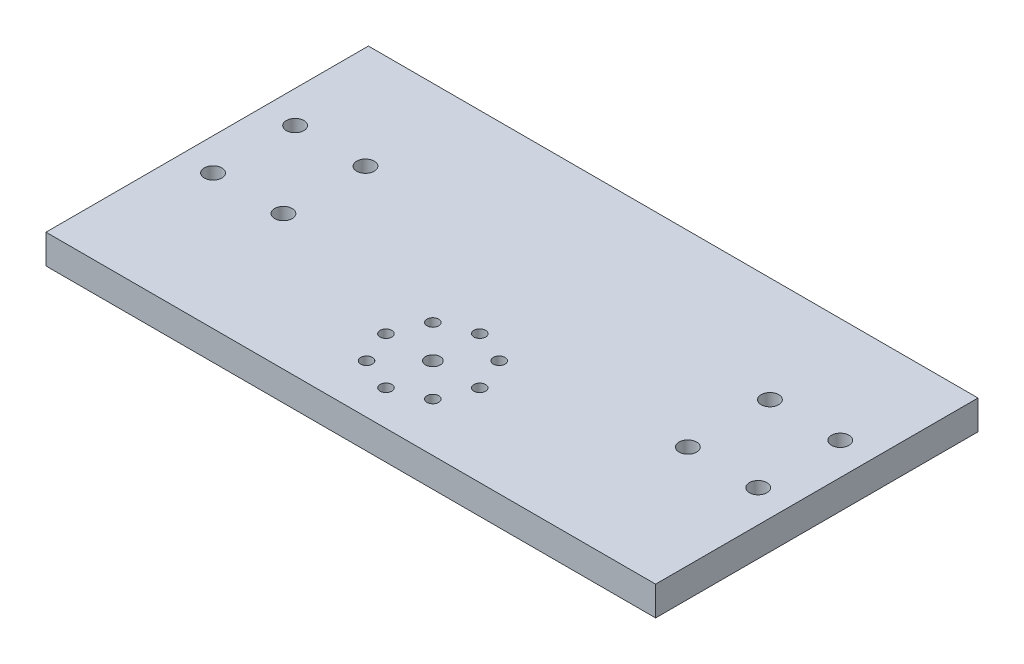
SolidWorks part; units mm, degrees
ref_plane "Front Plane" through (0, 0, 0) normal (0, 0, 1) x (1, 0, 0)
ref_plane "Top Plane" through (0, 0, 0) normal (0, 1, 0) x (1, 0, 0)
ref_plane "Right Plane" through (0, 0, 0) normal (1, 0, 0) x (0, 0, -1)
sketch "Sketch1" plane through (0, 0, 0) normal (0, 1, 0) x (1, 0, 0)
  line L0 (-52, 0) -> (52, 0) construction
  line L1 (-52, -25) -> (52, -25)
  line L2 (-52, -25) -> (-52, 25)
  line L3 (-52, 25) -> (52, 25)
  line L4 (52, -25) -> (52, 25)
  line L5 (-52, -25) -> (52, 25) construction
  line L6 (-52, 25) -> (52, -25) construction
  line L7 (0, 25) -> (0, -25) construction
  circle A0 centre (-46.5, 7) radius 1.5
  circle A1 centre (-34.5, 7) radius 1.5
  circle A2 centre (-34.5, -7) radius 1.5
  circle A3 centre (-46.5, -7) radius 1.5
  circle A4 centre (34.5, -7) radius 1.5
  circle A5 centre (46.5, -7) radius 1.5
  circle A6 centre (34.5, 7) radius 1.5
  circle A7 centre (46.5, 7) radius 1.5
  point P0 (0, 0)
  dimension "D3" = 7
  dimension "D4" = 7
  dimension "D5" = 3
  dimension "D6" = 3
  dimension "D1" = 104
  dimension "D2" = 50
  dimension "D7" = 12
  dimension "D8" = 5.5
extrude "Boss-Extrude1" add sketch "Sketch1" along normal blind 5
sketch "Sketch2" plane through (0, 0, 25) normal (0, 0, 1) x (1, 0, 0)
  line L1 (-52, 0) -> (52, 0)
  line L2 (-52, 0) -> (-52, 5)
  line L3 (-52, 5) -> (52, 5)
  line L4 (52, 0) -> (52, 5)
extrude "Boss-Extrude2" add sketch "Sketch2" along normal blind 5
sketch "Sketch4" plane through (0, 0, 0) normal (0, -1, 0) x (1, 0, 0)
  line L0 (0, 30) -> (0, -25) construction
  line L1 (-52, 30) -> (52, 30) construction
  line L2 (52, -25) -> (-52, -25) construction
  line L3 (-52, 16) -> (52, 16) construction
  line L4 (-52, -25) -> (-52, 30) construction
  line L5 (52, 30) -> (52, -25) construction
  circle A0 centre (0, 16) radius 1.25
  circle A1 centre (0, 24) radius 1
  circle A2 centre (5.6569, 21.6569) radius 1
  circle A3 centre (8, 16) radius 1
  circle A4 centre (5.6569, 10.3431) radius 1
  circle A5 centre (0, 8) radius 1
  circle A6 centre (-5.6569, 10.3431) radius 1
  circle A7 centre (-8, 16) radius 1
  circle A8 centre (-5.6569, 21.6569) radius 1
  point P33 (0, 16)
  dimension "D2" = 8
  dimension "D5" = 2.5
  dimension "D3" = 8
  dimension "D4" = 2
  dimension "D1" = 14
extrude "Cut-Extrude1" cut sketch "Sketch4" against normal through all
sketch "Sketch5" plane through (0, 0, 0) normal (0, -1, 0) x (1, 0, 0)
  circle A0 centre (0, 16) radius 4
  dimension "D1" = 8
extrude "Cut-Extrude2" cut sketch "Sketch5" against normal blind 2
